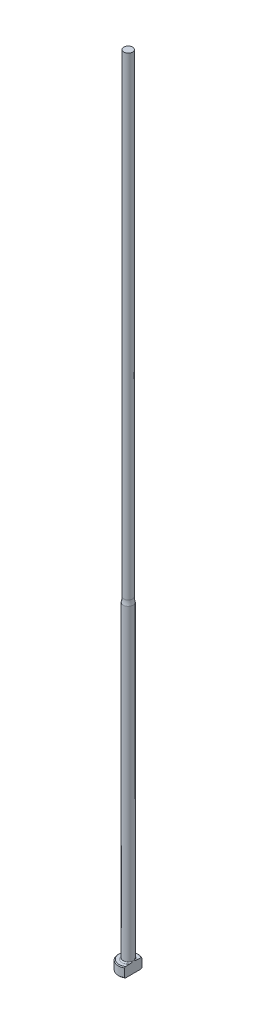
SolidWorks part; units mm, degrees
ref_plane "Front Plane" through (0, 0, 0) normal (0, 0, 1) x (1, 0, 0)
ref_plane "Top Plane" through (0, 0, 0) normal (0, 1, 0) x (1, 0, 0)
ref_plane "Right Plane" through (0, 0, 0) normal (1, 0, 0) x (0, 0, -1)
sketch "Sketch1" plane through (0, 0, 0) normal (0, 0, 1) x (1, 0, 0)
  line L0 (0, 259.9588) -> (0, -15.1925) construction
  line L1 (0, 0) -> (-3.175, 0)
  line L2 (-3.175, 0) -> (-3.175, 3.175)
  line L3 (-3.175, 3.175) -> (-1.5875, 3.175)
  line L4 (-1.3881, 103.1788) -> (-1.3881, 254)
  line L5 (-1.3881, 254) -> (0, 254)
  line L6 (0, 254) -> (0, 0)
  line L7 (-1.5875, 3.175) -> (-1.5875, 101.6)
  arc A0 (-1.5875, 101.6) -> (-1.3881, 103.1788) centre (-7.7381, 103.1788) ccw
  point P13 (-1.5875, 0)
  dimension "D1" = 6.35
  dimension "L" = 254
  dimension "D2" = 3.175
  dimension "H" = 6.35
  dimension "T" = 3.175
  dimension "D" = 2.7762
  dimension "S" = 101.6
revolve "Revolve1" add sketch "Sketch1" angle 360 about L0
chamfer "Chamfer1" distance 0.254 angle 45 2 edges at (0, 3.175, 3.175) (0, 0, 3.175)
fillet "Fillet1" radius 0.381 1 edges at (0, 3.175, 1.5875)
sketch "Sketch2" plane through (0, 0, 0) normal (0, 1, 0) x (1, 0, 0)
  line L0 (1.5875, -2.7496) -> (1.5875, 2.7496)
  circle A0 centre (0, 0) radius 3.175 construction
  arc A2 (1.5875, -2.7496) -> (1.5875, 2.7496) centre (0, 0) ccw
  circle A3 centre (0, 0) radius 3.175 construction
  circle A4 centre (0, 0) radius 1.5875 construction
extrude "Key Head" cut sketch "Sketch2" along normal up to next
